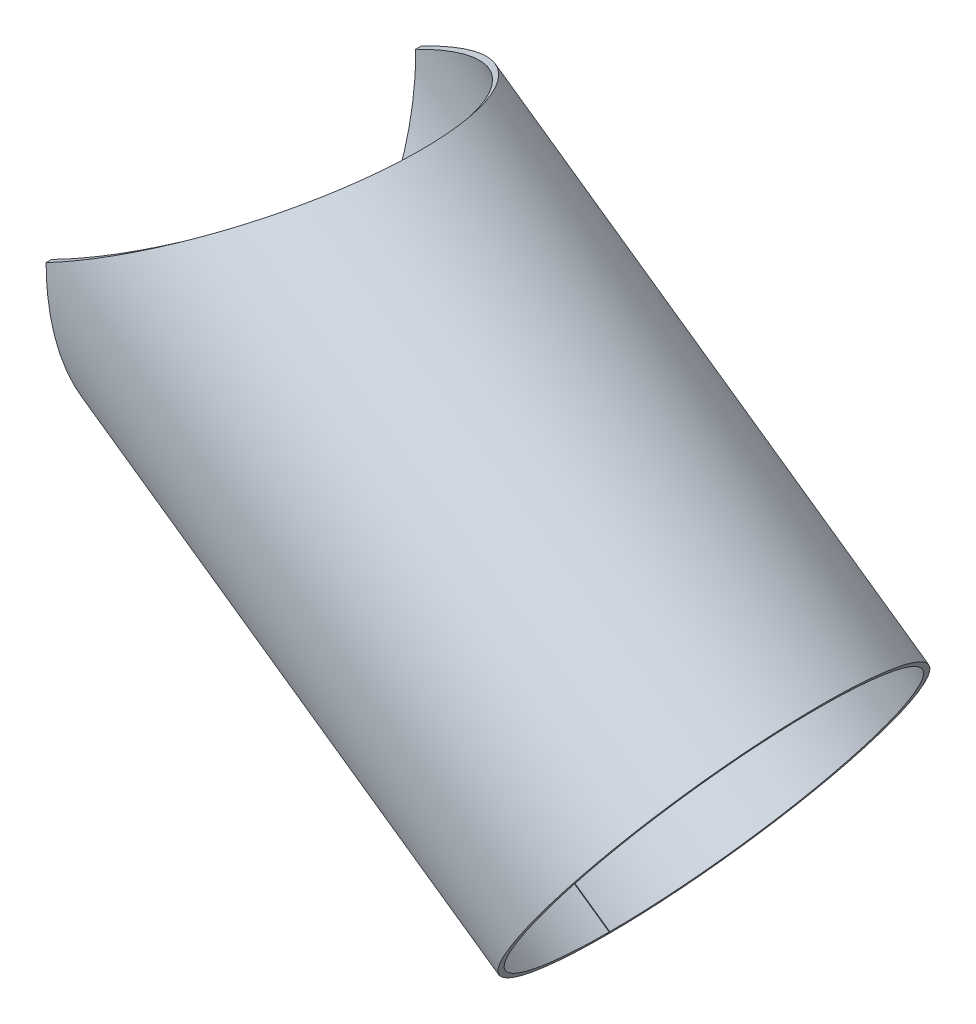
SolidWorks part; units mm, degrees
ref_plane "前视基准面" through (0, 0, 0) normal (0, 0, 1) x (1, 0, 0)
ref_plane "上视基准面" through (0, 0, 0) normal (0, 1, 0) x (1, 0, 0)
ref_plane "右视基准面" through (0, 0, 0) normal (1, 0, 0) x (0, 0, -1)
imported_body "基体零件-Y形补料管-1"
sheet metal parameters "钣金1" parameters "D1"=0.7366, "厚度"=8
bend "圆角折弯1" bend radius 267 bend angle 359.792 parameters "D5"=1
flatten bends "展开-折弯1" parameters "D1"=0
sketch "尖角-草图1" plane through (273.3687, -527.1273, -0.5) normal (-0.5736, -0.8192, -0.0018) x (0.8192, -0.5736, -0.0013)
  line L0 (334.7886, -837.8942) -> (-332.6541, -838.744) construction
process bends "加工-折弯1" parameters "D1"=0
sketch "平面-草图1" plane through (273.3687, -527.1273, -0.5) normal (-0.5736, -0.8192, -0.0018) x (0.8192, -0.5736, -0.0013)
